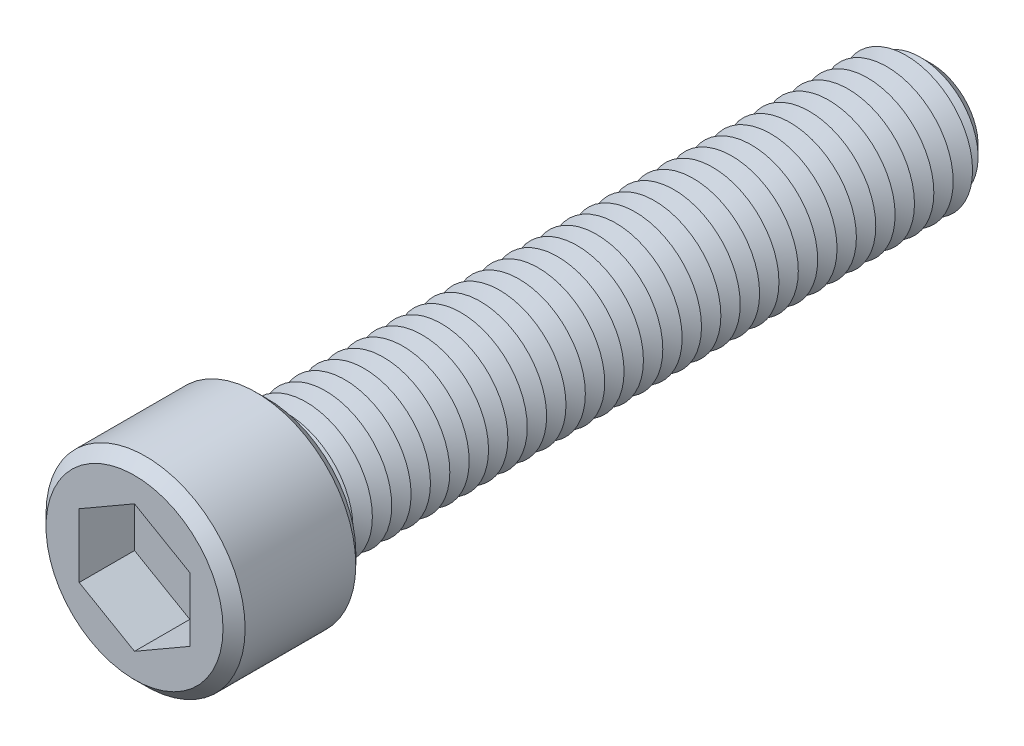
SolidWorks part; units mm, degrees
ref_plane "Front Plane" through (0, 0, 0) normal (0, 0, 1) x (1, 0, 0)
ref_plane "Top Plane" through (0, 0, 0) normal (0, 1, 0) x (1, 0, 0)
ref_plane "Right Plane" through (0, 0, 0) normal (1, 0, 0) x (0, 0, -1)
sketch "Sketch1" plane through (0, 0, 0) normal (0, 0, 1) x (1, 0, 0)
  circle A0 centre (0, 0) radius 9
  dimension "D1" = 18
extrude "Boss-Extrude1" add sketch "Sketch1" along normal blind 12
sketch "Sketch2" plane through (0, 0, 0) normal (0, 0, -1) x (-1, 0, 0)
  circle A0 centre (0, 0) radius 6
  dimension "D1" = 12
extrude "Boss-Extrude2" add sketch "Sketch2" along normal blind 60
chamfer "Chamfer1" distance 1.75 angle 45 1 edges at (-6, 0, -60)
sketch "Sketch3" plane through (0, 0, 0) normal (1, 0, 0) x (0, 0, -1)
  line L0 (-2.5121, 0) -> (4.5776, 0) construction
sketch "Sketch4" plane through (0, 0, 0) normal (1, 0, 0) x (0, 0, -1)
  line L0 (0, 6) -> (0.875, 4.4845)
  line L1 (0.875, 4.4845) -> (1.75, 6)
  line L2 (58.25, 6) -> (0, 6) construction
  line L3 (1.75, 6) -> (0, 6)
  dimension "D1" = 1.75
revolve "Cut-Revolve1" cut sketch "Sketch4" angle 360 about L0
pattern_linear "LPattern1" count 34 spacing 1.75 along (0, 0, -1) of "Cut-Revolve1"
sketch "Sketch5" plane through (0, 0, 12) normal (0, 0, 1) x (1, 0, 0)
  line L1 (0, 5.7735) -> (-5, 2.8868)
  line L2 (-5, 2.8868) -> (-5, -2.8868)
  line L3 (-5, -2.8868) -> (0, -5.7735)
  line L4 (0, -5.7735) -> (5, -2.8868)
  line L5 (5, -2.8868) -> (5, 2.8868)
  line L6 (5, 2.8868) -> (0, 5.7735)
  circle A0 centre (0, 0) radius 5 construction
  dimension "D1" = 10
extrude "Cut-Extrude1" cut sketch "Sketch5" against normal blind 5
sketch "Sketch6" plane through (0, 0, 7) normal (0, 0, 1) x (1, 0, 0)
  circle A0 centre (0, 0) radius 0.9
  dimension "D1" = 1.8
extrude "Cut-Extrude2" cut sketch "Sketch6" against normal up to surface (67 mm away)
chamfer "Chamfer2" distance 1 angle 45 2 edges at (9, 0, 0) (9, 0, 12)
